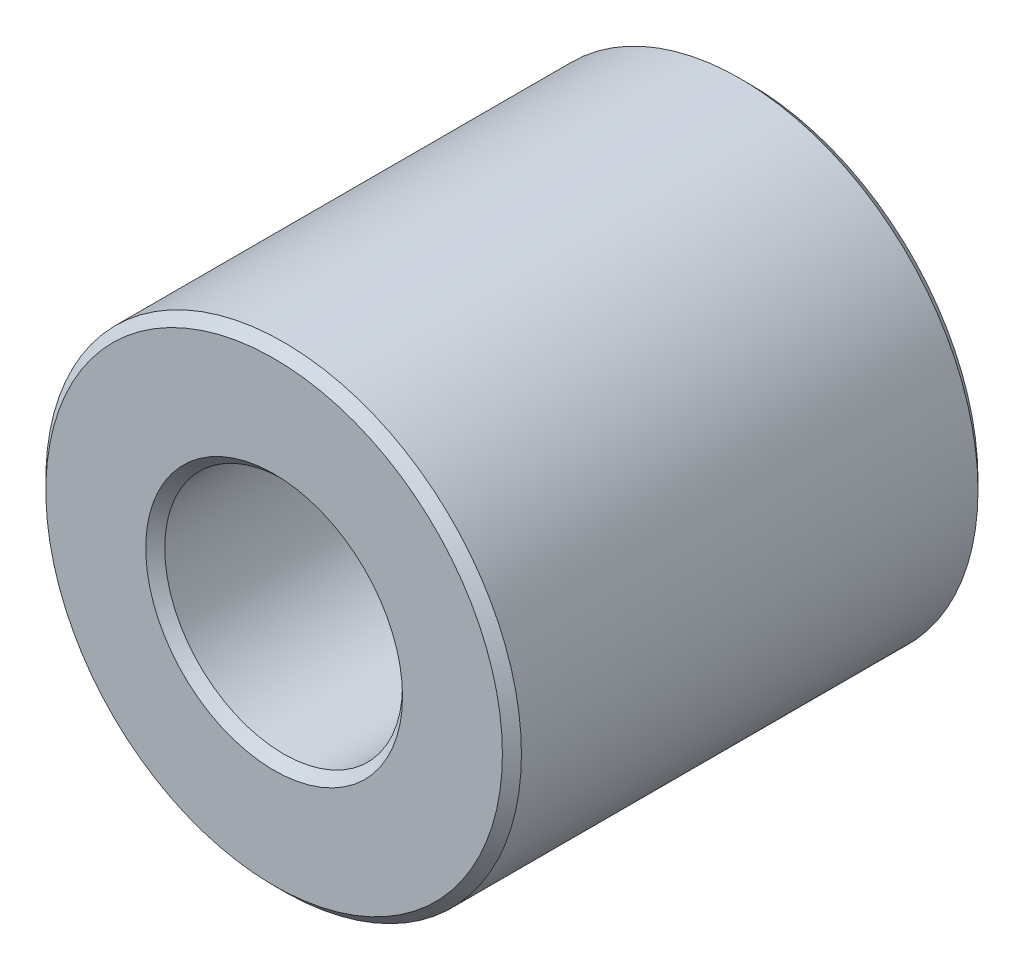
SolidWorks part; units mm, degrees
ref_plane "Front Plane" through (0, 0, 0) normal (0, 0, 1) x (1, 0, 0)
ref_plane "Top Plane" through (0, 0, 0) normal (0, 1, 0) x (1, 0, 0)
ref_plane "Right Plane" through (0, 0, 0) normal (1, 0, 0) x (0, 0, -1)
sketch "Sketch1" plane through (0, 0, 0) normal (0, 0, 1) x (1, 0, 0)
  circle A0 centre (0, 0) radius 2.5
  circle A1 centre (0, 0) radius 1.25
  dimension "D1" = 5
  dimension "D2" = 2.5
extrude "Boss-Extrude2" add sketch "Sketch1" along normal mid plane 5
chamfer "Chamfer3" distance 0.1 angle 45 4 edges at (2.5, 0, 2.5) (2.5, 0, -2.5) (1.25, 0, -2.5) (1.25, 0, 2.5)
